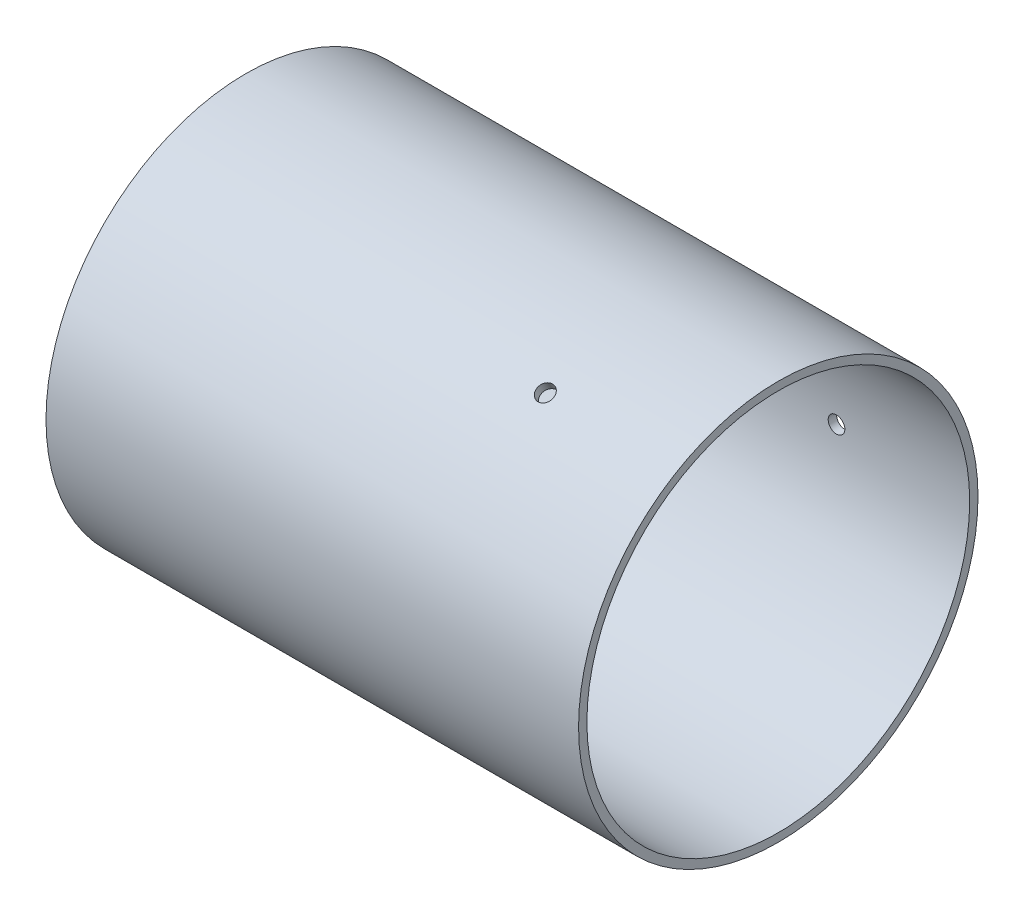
SolidWorks part; units mm, degrees
ref_plane "Front Plane" through (0, 0, 0) normal (0, 0, 1) x (1, 0, 0)
ref_plane "Top Plane" through (0, 0, 0) normal (0, 1, 0) x (1, 0, 0)
ref_plane "Right Plane" through (0, 0, 0) normal (1, 0, 0) x (0, 0, -1)
sketch "Sketch1" plane through (0, 0, 0) normal (1, 0, 0) x (0, 0, -1)
  circle A0 centre (0, 0) radius 38.1
  circle A1 centre (0, 0) radius 36.5125
  dimension "D1" = 76.2
  dimension "D2" = 73.025
extrude "Extrude1" add sketch "Sketch1" along normal blind 101.6
sketch "Sketch2" plane through (0, 0, 0) normal (0, 0, 1) x (1, 0, 0)
  line L0 (0, 0) -> (101.6, 0) construction
  line L1 (101.6, -38.1) -> (101.6, 38.1) construction
ref_plane "Plane1" through (0, 0, 0) normal (0, -0.866, -0.5) x (1, 0, 0)
ref_plane "Plane2" through (0, 0, 0) normal (0, 0.866, -0.5) x (-1, 0, 0)
sketch "Sketch3" plane through (0, 0, 0) normal (0, 0, 1) x (1, 0, 0)
  line L0 (0, 0) -> (101.6, 0) construction
  line L1 (101.6, -38.1) -> (101.6, 38.1) construction
  circle A0 centre (76.2, 0) radius 1.5875
  dimension "D2" = 3.175
  dimension "D1" = 25.4
extrude "Cut-Extrude1" cut sketch "Sketch3" against normal through all
sketch "Sketch4" plane through (0, 0, 0) normal (0, -0.866, -0.5) x (1, 0, 0)
  line L0 (0, 0) -> (101.6, 0) construction
  line L1 (101.6, -38.1) -> (101.6, 38.1) construction
  circle A0 centre (76.2, 0) radius 1.5875
  dimension "D2" = 3.175
  dimension "D1" = 25.4
extrude "Cut-Extrude2" cut sketch "Sketch4" against normal through all
sketch "Sketch5" plane through (0, 0, 0) normal (0, 0.866, -0.5) x (-1, 0, 0)
  line L0 (0, 0) -> (-101.6, 0) construction
  line L1 (-101.6, 38.1) -> (-101.6, -38.1) construction
  circle A0 centre (-76.2, 0) radius 1.5875
  dimension "D2" = 3.175
  dimension "D1" = 25.4
extrude "Cut-Extrude3" cut sketch "Sketch5" against normal through all
